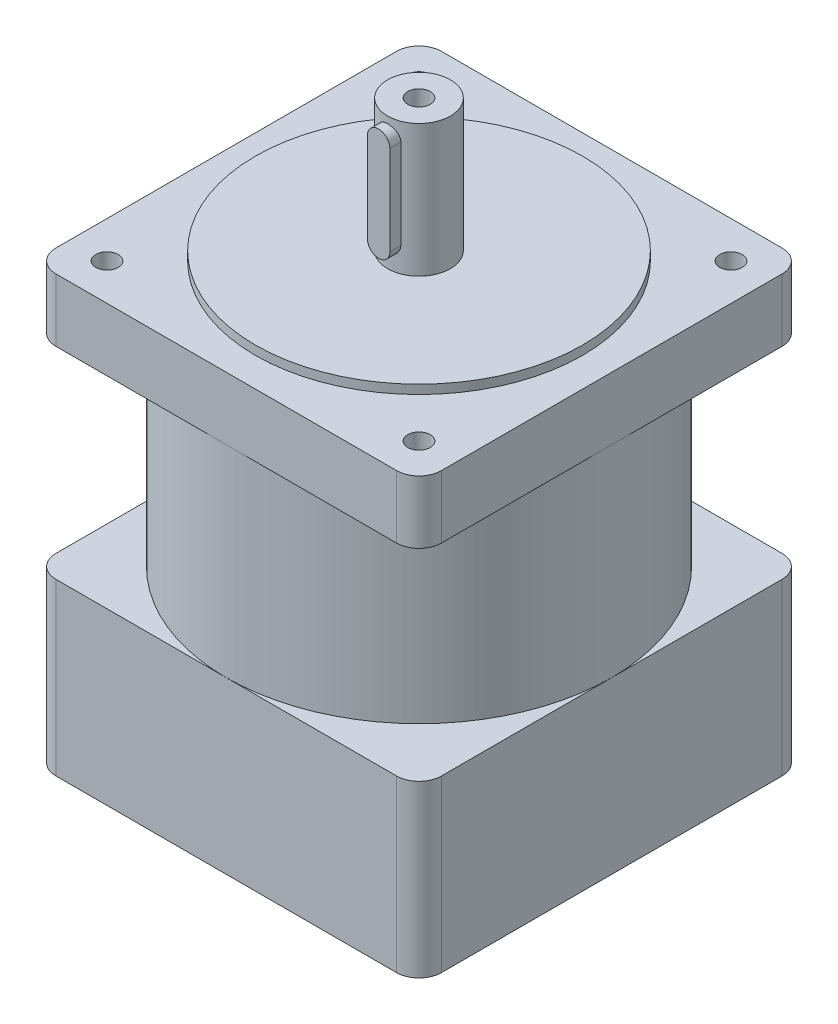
SolidWorks part; units mm, degrees
ref_plane "前视" through (0, 0, 0) normal (0, 0, 1) x (1, 0, 0)
ref_plane "上视" through (0, 0, 0) normal (0, 1, 0) x (1, 0, 0)
ref_plane "右视" through (0, 0, 0) normal (1, 0, 0) x (0, 0, -1)
sketch "草图1" plane through (0, 0, 0) normal (0, 1, 0) x (1, 0, 0)
  line L1 (-43, 43) -> (43, 43)
  line L2 (-43, 43) -> (-43, -43)
  line L3 (-43, -43) -> (43, -43)
  line L4 (43, 43) -> (43, -43)
  line L5 (-43, 43) -> (43, -43) construction
  line L6 (-43, -43) -> (43, 43) construction
  point P0 (0, 0)
extrude "凸台-拉伸1" add sketch "草图1" along normal blind 14
fillet "圆角1" radius 5 4 edges at (-43, 7, -43) (43, 7, -43) (43, 7, 43) (-43, 7, 43)
ref_plane "基准面1" through (0, 14, 0) normal (0, 1, 0) x (1, 0, 0)
sketch "草图2" plane through (0, 14, 0) normal (0, 1, 0) x (1, 0, 0)
  circle A0 centre (0, 0) radius 36.5
  dimension "D1" = 73
extrude "凸台-拉伸2" add sketch "草图2" along normal blind 2
sketch "草图3" plane through (0, 14, 0) normal (0, 1, 0) x (1, 0, 0)
  circle A0 centre (0, 0) radius 7
  dimension "D1" = 14
extrude "凸台-拉伸3" add sketch "草图3" along normal blind 31.5
ref_plane "基准面2" through (0, 0, 4) normal (0, 0, 1) x (1, 0, 0)
sketch "草图4" plane through (0, 0, 4) normal (0, 0, 1) x (1, 0, 0)
  line L2 (-2.5, 41.5) -> (-2.5, 21.5)
  line L4 (2.5, 41.5) -> (2.5, 21.5)
  arc A0 (-2.5, 41.5) -> (2.5, 41.5) centre (0, 41.5) cw
  arc A1 (-2.5, 21.5) -> (2.5, 21.5) centre (0, 21.5) ccw
  dimension "D1" = 2.5
  dimension "D2" = 2.5
extrude "凸台-拉伸4" add sketch "草图4" along normal blind 5
ref_plane "基准面3" through (0, 45.5, 0) normal (0, 1, 0) x (1, 0, 0)
hole_wizard "M6 螺纹孔1" positions "草图6" profile "草图5" tap size "M6" standard "ISO"
sketch "草图6" plane through (0, 45.5, 0) normal (0, 1, 0) x (1, 0, 0)
  point P0 (0, 0)
sketch "草图5" plane through (0, 45.5, 0) normal (1, 0, 0) x (0, 0, 1)
  line L0 (0, 0) -> (0, 18.5022)
  line L1 (0, 18.5022) -> (2.5, 17)
  line L2 (2.5, 17) -> (2.5, 0)
  line L5 (2.5, 0) -> (0, 0)
  line L10 (0, 18.5022) -> (-2.5, 17) construction
  line L11 (0, -6.35) -> (0, 107.95) construction
  dimension "螺纹孔钻头直径" = 5
  dimension "螺纹孔钻头深度" = 17
  dimension "导头角度" = 118
sketch "草图7" plane through (0, 0, 0) normal (0, 1, 0) x (1, 0, 0)
  circle A0 centre (0, 0) radius 43
  dimension "D1" = 86
extrude "凸台-拉伸5" add sketch "草图7" against normal blind 45
ref_plane "基准面4" through (0, -45, 0) normal (0, -1, 0) x (-1, 0, 0)
sketch "草图8" plane through (0, -45, 0) normal (0, -1, 0) x (-1, 0, 0)
  line L1 (43, -43) -> (-43, -43)
  line L2 (43, -43) -> (43, 43)
  line L3 (43, 43) -> (-43, 43)
  line L4 (-43, -43) -> (-43, 43)
  line L5 (43, -43) -> (-43, 43) construction
  line L6 (43, 43) -> (-43, -43) construction
  point P0 (0, 0)
extrude "凸台-拉伸6" add sketch "草图8" along normal blind 38
fillet "圆角2" radius 5 4 edges at (-43, -64, -43) (43, -64, -43) (43, -64, 43) (-43, -64, 43)
ref_plane "基准面5" through (0, -83, 0) normal (0, -1, 0) x (-1, 0, 0)
sketch "草图9" plane through (0, -83, 0) normal (0, -1, 0) x (-1, 0, 0)
  circle A0 centre (0, 0) radius 36.5
  dimension "D1" = 73
extrude "切除-拉伸1" cut sketch "草图9" against normal blind 5
sketch "草图10" plane through (0, -83, 0) normal (0, -1, 0) x (-1, 0, 0)
  line L0 (2.5, -9) -> (2.5, -6.5383)
  line L2 (-2.5, -9) -> (2.5, -9)
  line L3 (-2.5, -9) -> (-2.5, -6.5383)
  arc A0 (-2.5, -6.5383) -> (2.5, -6.5383) centre (0, 0) cw
  dimension "D1" = 7
extrude "切除-拉伸3" cut sketch "草图10" against normal blind 34
sketch "草图11" plane through (0, -83, 0) normal (0, -1, 0) x (-1, 0, 0)
  line L1 (34.8, -34.8) -> (-34.8, -34.8)
  line L2 (34.8, -34.8) -> (34.8, 34.8)
  line L3 (34.8, 34.8) -> (-34.8, 34.8)
  line L4 (-34.8, -34.8) -> (-34.8, 34.8)
  line L5 (34.8, -34.8) -> (-34.8, 34.8) construction
  line L6 (34.8, 34.8) -> (-34.8, -34.8) construction
  point P0 (0, 0)
hole_wizard "M6 螺纹孔2" positions "草图13" profile "草图12" tap size "M6" standard "ISO"
sketch "草图13" plane through (0, -83, 0) normal (0, -1, 0) x (-1, 0, 0)
  point P0 (34.8, -34.8)
  point P3 (34.8, 34.8)
  point P6 (-34.8, 34.8)
  point P9 (-34.8, -34.8)
sketch "草图12" plane through (-34.8, -83, 34.8) normal (1, 0, 0) x (0, 0, -1)
  line L0 (0, 0) -> (0, 18.5022)
  line L1 (0, 18.5022) -> (2.5, 17)
  line L2 (2.5, 17) -> (2.5, 0)
  line L5 (2.5, 0) -> (0, 0)
  line L10 (0, 18.5022) -> (-2.5, 17) construction
  line L11 (0, -6.35) -> (0, 107.95) construction
  dimension "螺纹孔钻头直径" = 5
  dimension "螺纹孔钻头深度" = 17
  dimension "导头角度" = 118
hole_wizard "M6 螺纹孔3" positions "草图16" profile "草图15" tap size "M6" standard "ISO"
sketch "草图16" plane through (0, 14, 0) normal (0, 1, 0) x (1, 0, 0)
  point P0 (-34.8, 34.8)
  point P3 (-34.8, -34.8)
  point P6 (34.8, -34.8)
  point P9 (34.8, 34.8)
sketch "草图15" plane through (-34.8, 14, -34.8) normal (1, 0, 0) x (0, 0, 1)
  line L0 (0, 0) -> (0, 20.5022)
  line L1 (0, 20.5022) -> (2.5, 19)
  line L2 (2.5, 19) -> (2.5, 0)
  line L5 (2.5, 0) -> (0, 0)
  line L10 (0, 20.5022) -> (-2.5, 19) construction
  line L11 (0, -6.35) -> (0, 107.95) construction
  dimension "螺纹孔钻头直径" = 5
  dimension "螺纹孔钻头深度" = 19
  dimension "导头角度" = 118
